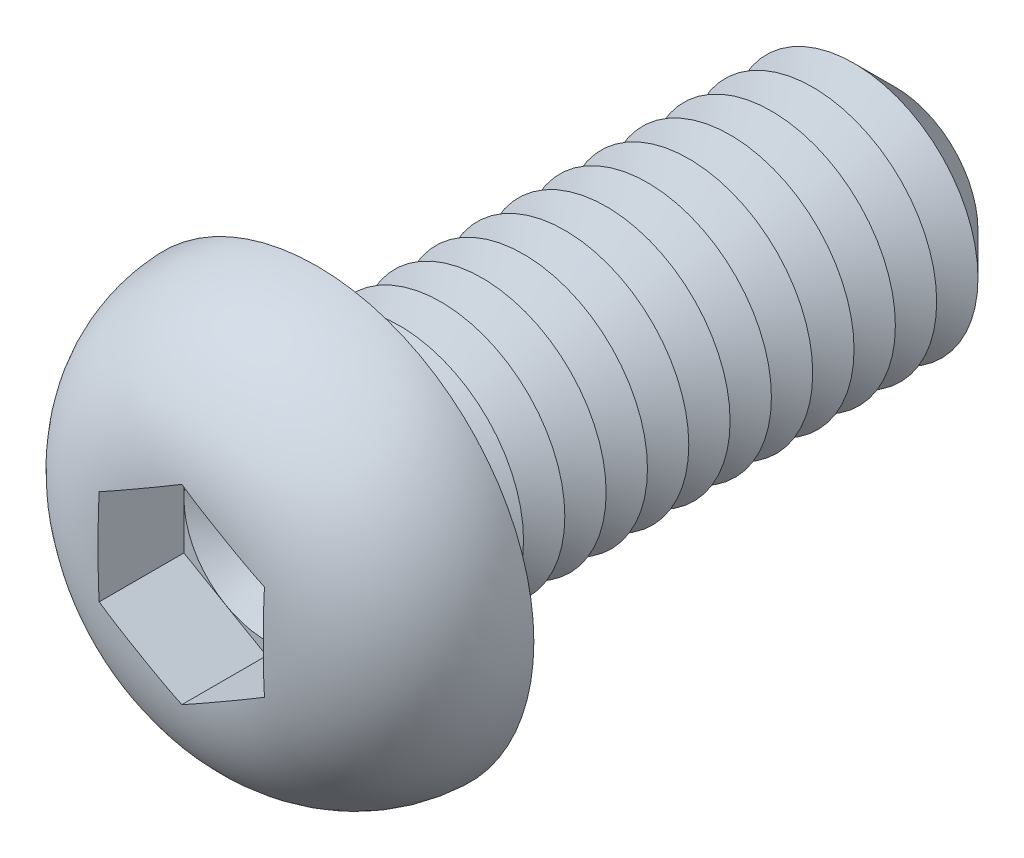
SolidWorks part; units mm, degrees
ref_plane "Front Plane" through (0, 0, 0) normal (0, 0, 1) x (1, 0, 0)
ref_plane "Top Plane" through (0, 0, 0) normal (0, 1, 0) x (1, 0, 0)
ref_plane "Right Plane" through (0, 0, 0) normal (1, 0, 0) x (0, 0, -1)
sketch "Sketch1" plane through (0, 0, 0) normal (1, 0, 0) x (0, 0, -1)
  line L0 (-47.9342, 0) -> (60.3146, 0) construction
sketch "Sketch2" plane through (0, 0, 0) normal (1, 0, 0) x (0, 0, -1)
  line L0 (0, 0) -> (-3.3, 0)
  line L1 (-47.9342, 0) -> (60.3146, 0) construction
  line L2 (-3.3, 0) -> (-3.3, 1.8515)
  line L3 (0, 5.25) -> (0, 0)
  arc A0 (-3.3, 1.8515) -> (0, 5.25) centre (0.1, 1.8515) cw
  dimension "D1" = 3.4
  dimension "D2" = 3.3
  dimension "D3" = 5.25
revolve "Revolve1" add sketch "Sketch2" angle 360 about L0
sketch "Sketch3" plane through (0, 0, 3.3) normal (0, 0, 1) x (1, 0, 0)
  line L1 (0, 2.3094) -> (-2, 1.1547)
  line L2 (-2, 1.1547) -> (-2, -1.1547)
  line L3 (-2, -1.1547) -> (0, -2.3094)
  line L4 (0, -2.3094) -> (2, -1.1547)
  line L5 (2, -1.1547) -> (2, 1.1547)
  line L6 (2, 1.1547) -> (0, 2.3094)
  circle A0 centre (0, 0) radius 2 construction
  dimension "D1" = 4
extrude "Cut-Extrude1" cut sketch "Sketch3" against normal blind 2.08
sketch "Sketch4" plane through (0, 0, 0) normal (0, 0, -1) x (-1, 0, 0)
  circle A0 centre (0, 0) radius 3
  dimension "D1" = 6
extrude "Boss-Extrude1" add sketch "Sketch4" along normal blind 14
chamfer "Chamfer1" distance 1 angle 45 1 edges at (-3, 0, -14)
sketch "Sketch5" plane through (0, 0, 0) normal (1, 0, 0) x (0, 0, -1)
  line L0 (1, 3) -> (2, 3)
  line L1 (13, 3) -> (0, 3) construction
  line L2 (2, 3) -> (1.5, 2.134)
  line L3 (1.5, 2.134) -> (1, 3)
  line L4 (0, -5.25) -> (0, 5.25) construction
  line L5 (13, 3) -> (0, 3) construction
  dimension "D1" = 1
  dimension "D2" = 1
revolve "Cut-Revolve1" cut sketch "Sketch5" angle 360 about L0
pattern_linear "LPattern1" count 12 spacing 1 along (0, 0, -1) of "Cut-Revolve1"
fillet "Fillet2" radius 0.5 1 edges at (-3, 0, 0)
sketch "Sketch6" plane through (0, 0, 1.22) normal (0, 0, 1) x (1, 0, 0)
  line L0 (0, -2.3094) -> (2, -1.1547) construction
  circle A0 centre (0, 0) radius 2
extrude "Cut-Extrude2" cut sketch "Sketch6" against normal through all draft 60
